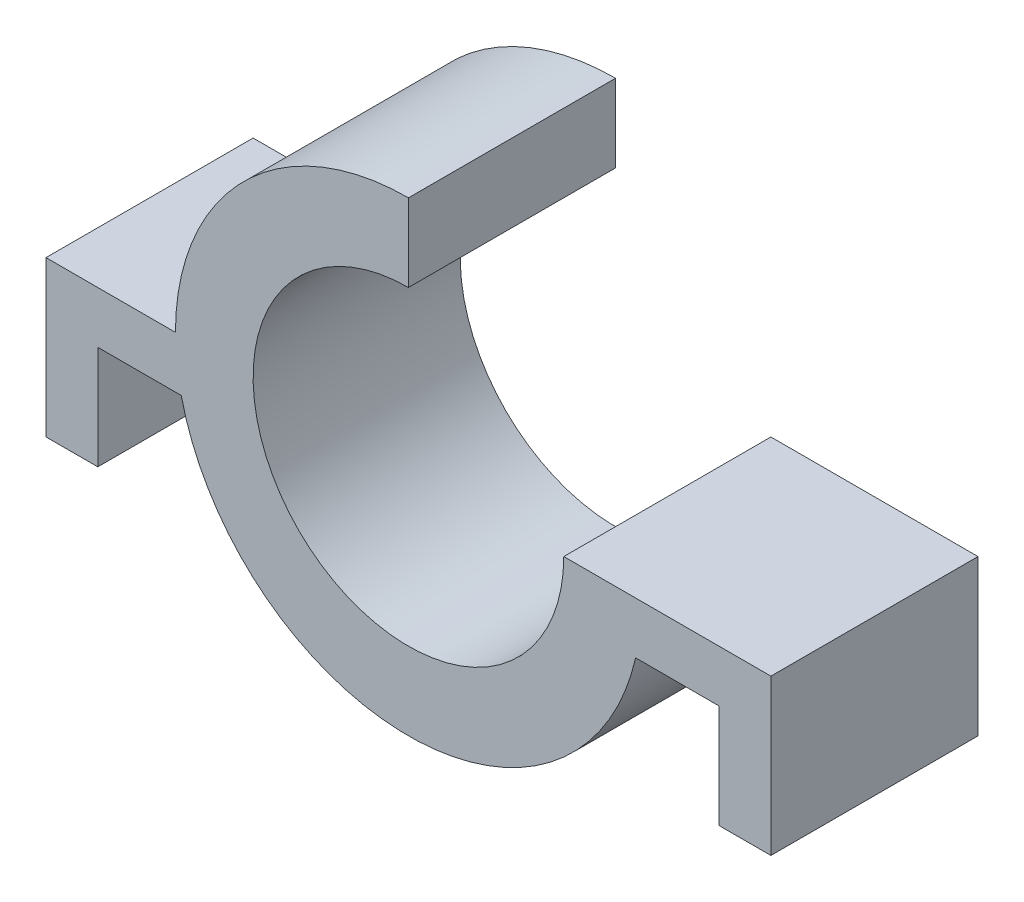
SolidWorks part; units mm, degrees
ref_plane "前视基准面" through (0, 0, 0) normal (0, 0, 1) x (1, 0, 0)
ref_plane "上视基准面" through (0, 0, 0) normal (0, 1, 0) x (1, 0, 0)
ref_plane "右视基准面" through (0, 0, 0) normal (1, 0, 0) x (0, 0, -1)
sketch "草图1" plane through (0, 0, 0) normal (0, 0, 1) x (1, 0, 0)
  circle A0 centre (0, 0) radius 3
  circle A1 centre (0, 0) radius 4.5
  dimension "D1" = 1.5
extrude "凸台-拉伸1" add sketch "草图1" along normal blind 4
sketch "草图2" plane through (0, 0, 4) normal (0, 0, 1) x (1, 0, 0)
  line L1 (0, 0) -> (4.5, 0)
  line L2 (0, 0) -> (0, 4.5)
  line L3 (0, 4.5) -> (4.5, 4.5)
  line L4 (4.5, 0) -> (4.5, 4.5)
extrude "切除-拉伸1" cut sketch "草图2" against normal through all
sketch "草图3" plane through (0, 0, 4) normal (0, 0, 1) x (1, 0, 0)
  line L1 (3, 0) -> (7, 0)
  line L2 (3, 0) -> (3, -1)
  line L3 (3, -1) -> (7, -1)
  line L4 (7, 0) -> (7, -1)
  line L5 (7, -1) -> (6, -1)
  line L6 (7, -1) -> (7, -3)
  line L7 (7, -3) -> (6, -3)
  line L8 (6, -1) -> (6, -3)
extrude "凸台-拉伸3" add sketch "草图3" against normal through all contours L4 L1 L3 M2 | L3 L8 L7 L6
sketch "草图4" plane through (0, 0, 4) normal (0, 0, 1) x (1, 0, 0)
  line L0 (0, 0) -> (-4.5, 0) construction
  line L2 (-3, 0) -> (-7, 0)
  line L3 (-3, 0) -> (-3, -1)
  line L4 (-3, -1) -> (-7, -1)
  line L5 (-7, 0) -> (-7, -1)
  line L6 (-7, -1) -> (-6, -1)
  line L7 (-7, -1) -> (-7, -3)
  line L8 (-7, -3) -> (-6, -3)
  line L9 (-6, -1) -> (-6, -3)
  arc A0 (0, 4.5) -> (4.3875, -1) centre (0, 0) ccw construction
  arc A1 (0, 3) -> (3, 0) centre (0, 0) ccw construction
extrude "凸台-拉伸4" add sketch "草图4" against normal through all contours L2 L5 L4 M2 | L9 L4 L7 L8
